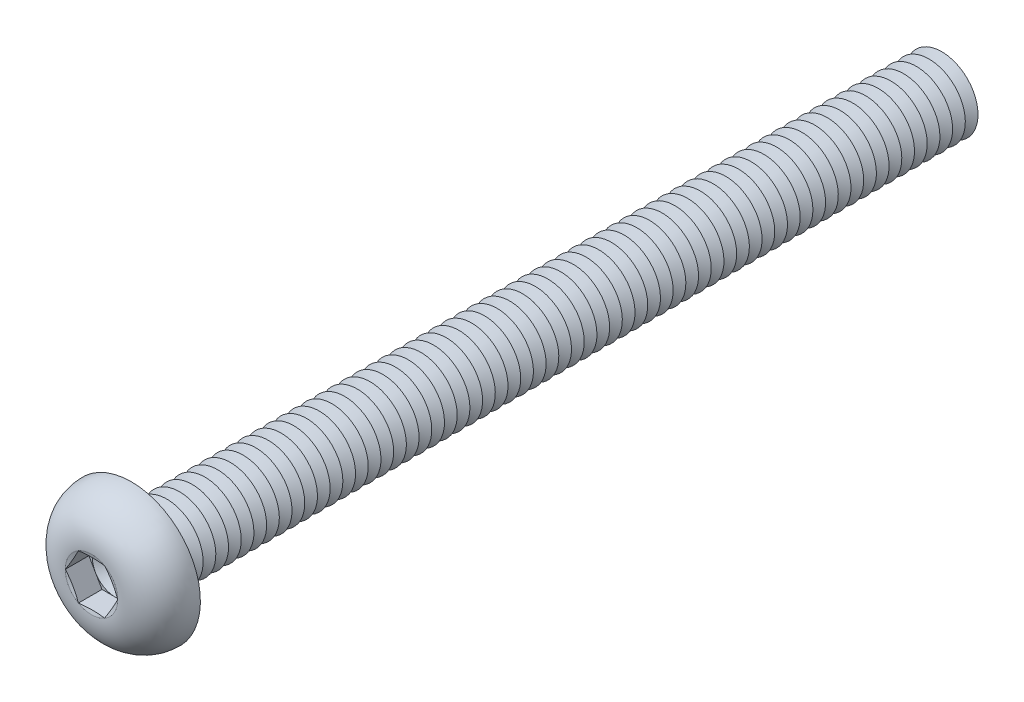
SolidWorks part; units mm, degrees
ref_plane "Front Plane" through (0, 0, 0) normal (0, 0, 1) x (1, 0, 0)
ref_plane "Top Plane" through (0, 0, 0) normal (0, 1, 0) x (1, 0, 0)
ref_plane "Right Plane" through (0, 0, 0) normal (1, 0, 0) x (0, 0, -1)
sketch "Sketch1" plane through (0, 0, 0) normal (1, 0, 0) x (0, 0, -1)
  line L0 (0, 2) -> (0, 3.8)
  line L3 (0, 2) -> (45, 2)
  line L4 (45, 2) -> (45, 0)
  line L5 (45, 0) -> (-2.2, 0) construction
  line L6 (-2.2, 0) -> (45, 0)
  line L7 (-2.2, 1.4434) -> (-2.2, 0.7217) construction
  line L8 (-2.2, 0.7217) -> (-2.2, 0)
  line L9 (-2.2, 1.4434) -> (-2.0066, 0.7217)
  line L10 (-2.0066, 0.7217) -> (-2.2, 0.7217)
  line L11 (45, 0) -> (22.7481, 0) construction
  line L12 (0, 3.8) -> (-2.2, 3.8) construction
  arc A1 (0, 3.8) -> (-2.2, 1.4434) centre (0, 1.5948) ccw
  point P8 (45, 1)
  dimension "D1" = 7.6
  dimension "D2" = 4
  dimension "D3" = 2.2
  dimension "D4" = 2.8868
  dimension "D5" = 45
  dimension "D6" = 15
revolve "Revolve1" add sketch "Sketch1" angle 360 about L5
fillet "Fillet1" radius 0.35 1 edges at (0, 2, 0)
sketch "Sketch2" plane through (0, 0, 0) normal (1, 0, 0) x (0, 0, -1)
  line L0 (44.65, 2) -> (45.35, 2)
  line L1 (45, 2) -> (0.35, 2) construction
  line L2 (45.35, 2) -> (45, 1.3938)
  line L3 (45, -2) -> (45, 2) construction
  line L4 (45, 1.3938) -> (44.65, 2)
  dimension "D1" = 0.7
revolve "Cut-Revolve1" cut sketch "Sketch2" angle 360 about axis through (0, 0, -45) along (0, 0, -1)
pattern_linear "LPattern1" count 64 spacing 0.7 along (0, 0, 1) of "Cut-Revolve1"
sketch "Sketch3" plane through (0, 0, 2.2) normal (0, 0, 1) x (1, 0, 0)
  line L7 (0.7217, 1.25) -> (-0.7217, 1.25)
  line L8 (-0.7217, 1.25) -> (-1.4434, 0)
  line L9 (-1.4434, 0) -> (-0.7217, -1.25)
  line L10 (-0.7217, -1.25) -> (0.7217, -1.25)
  line L11 (0.7217, -1.25) -> (1.4434, 0)
  line L12 (1.4434, 0) -> (0.7217, 1.25)
  circle A0 centre (0, 0) radius 1.25 construction
  circle A3 centre (0, 0) radius 1.4434 construction
extrude "Cut-Extrude1" cut sketch "Sketch3" against normal blind 1.3
sketch "Sketch4" plane through (0, 0, 0.9) normal (0, 0, 1) x (1, 0, 0)
  line L1 (0.7217, 1.25) -> (-0.7217, 1.25) construction
  circle A0 centre (0, 0) radius 1.25
extrude "Cut-Extrude2" cut sketch "Sketch4" against normal through all draft 60
